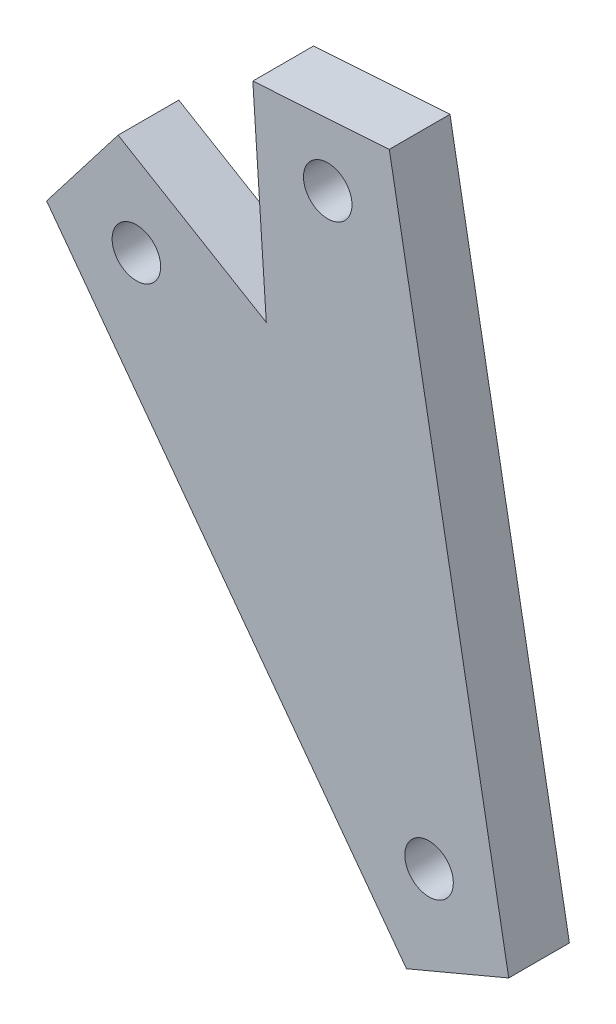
SolidWorks part; units mm, degrees
ref_plane "Front Plane" through (0, 0, 0) normal (0, 0, 1) x (1, 0, 0)
ref_plane "Top Plane" through (0, 0, 0) normal (0, 1, 0) x (1, 0, 0)
ref_plane "Right Plane" through (0, 0, 0) normal (1, 0, 0) x (0, 0, -1)
sketch "Sketch1" plane through (0, 0, 0) normal (0, 0, 1) x (1, 0, 0)
  line L0 (-40.0259, 40.5283) -> (-2.3619, -10.2323)
  line L1 (-2.3619, -10.2323) -> (8.3384, -5.7184)
  line L2 (8.3384, -5.7184) -> (-4.1591, 63.1379)
  line L3 (-4.1591, 63.1379) -> (-18.4423, 62.187)
  line L4 (-18.4423, 62.187) -> (-17.0326, 41.0113)
  line L5 (-17.0326, 41.0113) -> (-32.5418, 50.2345)
  line L6 (-32.5418, 50.2345) -> (-40.0259, 40.5283)
  circle A0 centre (-10.606, 56.1572) radius 2.54
  circle A1 centre (-30.6284, 40.5283) radius 2.54
  circle A2 centre (0, 0) radius 2.54
  point P0 (0, 0)
  point P1 (-10.606, 56.1572)
  point P3 (-30.6284, 40.5283)
  dimension "D4" = 5.08
  dimension "D5" = 5.08
  dimension "D6" = 5.08
  dimension "D1" = 50.8
  dimension "D2" = 57.15
  dimension "D3" = 25.4
extrude "Boss-Extrude1" add sketch "Sketch1" along normal blind 6.35
